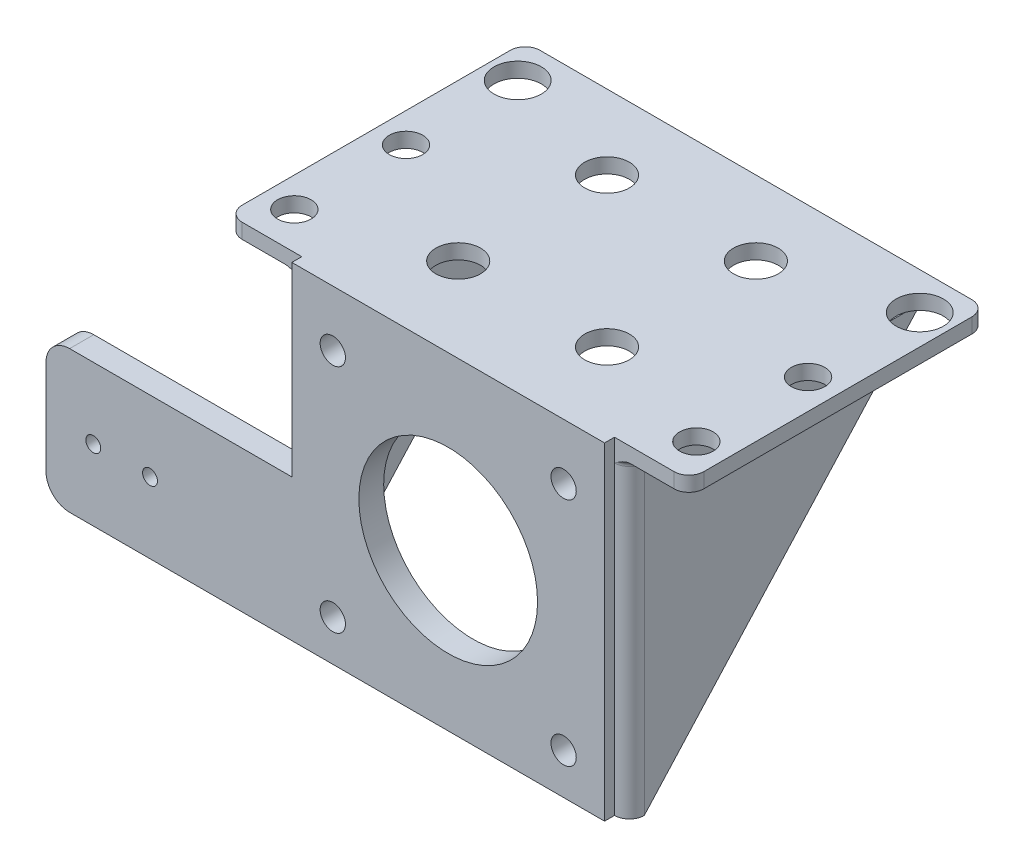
SolidWorks part; units mm, degrees
other "Solid1"
ref_plane "Front Plane" through (0, 0, 0) normal (0, 0, 1) x (1, 0, 0)
ref_plane "Top Plane" through (0, 0, 0) normal (0, 1, 0) x (1, 0, 0)
ref_plane "Right Plane" through (0, 0, 0) normal (1, 0, 0) x (0, 0, -1)
imported_body "Imported1"
sketch "Sketch1" plane through (0, 0, 2) normal (0, 0, 1) x (1, 0, 0)
  line L0 (-21, -11.475) -> (-54.02, -11.475) construction
  line L1 (-21, -21) -> (-50.845, -21)
  line L2 (-21, -21) -> (-21, -1.95)
  line L3 (-21, -1.95) -> (-50.845, -1.95)
  line L4 (-54.02, -17.825) -> (-54.02, -5.125)
  circle A0 centre (-40.05, -11.475) radius 1
  circle A1 centre (-47.67, -11.475) radius 1
  arc A2 (-50.845, -21) -> (-54.02, -17.825) centre (-50.845, -17.825) cw
  arc A3 (-50.845, -1.95) -> (-54.02, -5.125) centre (-50.845, -5.125) ccw
  point P11 (-53.4865, -11.475)
  point P17 (-54.02, -1.95)
  dimension "D1" = 7.62
  dimension "D3" = 2
  dimension "D6" = 3.175
  dimension "D2" = 19.05
  dimension "D4" = 6.35
  dimension "D5" = 19.05
extrude "Boss-Extrude1" add sketch "Sketch1" against normal blind 1.905
ref_plane "Plane1" through (0, -11.475, 0) normal (0, -1, 0) x (-1, 0, 0)
sketch "Sketch2" plane through (0, -11.475, 0) normal (0, -1, 0) x (1, 0, 0)
  line L0 (-23, 0.095) -> (-23, -7.7034)
  line L2 (-23, -7.7034) -> (-37.1371, 0.095)
  line L3 (-37.1371, 0.095) -> (-23, 0.095)
  line L4 (-23, -37.0952) -> (-23, 0) construction
  line L5 (-50.845, 0.095) -> (-22.9977, 0.095) construction
  point P2 (-23, -7.7034)
  point P8 (-37.1371, 0.095)
extrude "Boss-Extrude2" add sketch "Sketch2" along normal mid plane 1.905
sketch "Sketch3" plane through (0, 21, 0) normal (0, -1, 0) x (-1, 0, 0)
  line L0 (31, 18) -> (-31, 18) construction
  line L2 (31, 36) -> (31, 0) construction
  line L3 (9.9949, 27.9949) -> (-9.9949, 27.9949) construction
  line L4 (9.9949, 27.9949) -> (9.9949, 8.0051) construction
  line L5 (9.9949, 8.0051) -> (-9.9949, 8.0051) construction
  line L6 (-9.9949, 27.9949) -> (-9.9949, 8.0051) construction
  line L7 (9.9949, 27.9949) -> (-9.9949, 8.0051) construction
  line L8 (9.9949, 8.0051) -> (-9.9949, 27.9949) construction
  line L9 (-31, 0) -> (-31, 36) construction
  circle A0 centre (9.9949, 8.0051) radius 3
  circle A1 centre (9.9949, 27.9949) radius 3
  circle A2 centre (-9.9949, 27.9949) radius 3
  circle A3 centre (-9.9949, 8.0051) radius 3
  point P5 (0, 18)
  dimension "D1" = 6
  dimension "D2" = 19.9898
extrude "Cut-Extrude1" cut sketch "Sketch3" against normal through all
sketch "Sketch4" plane through (0, 0, 2) normal (0, 0, 1) x (1, 0, 0)
  line L0 (21, 20) -> (21, 23)
  line L1 (-21, 20) -> (-21, 23)
  line L11 (-50.845, -21) -> (21, -21)
  line L12 (21, -21) -> (21, 20)
  line L13 (23.2361, 21) -> (29, 21)
  line L14 (29, 21) -> (29, 23)
  line L15 (29, 23) -> (-29, 23)
  line L16 (-29, 23) -> (-29, 21)
  line L17 (-29, 21) -> (-23.2361, 21)
  line L18 (-21, 20) -> (-21, -1.95)
  line L19 (-21, -1.95) -> (-50.845, -1.95)
  line L20 (-54.02, -5.125) -> (-54.02, -17.825)
  line L21 (-50.845, -21) -> (21, -21)
  line L22 (21, -21) -> (21, 20)
  line L25 (21, 23) -> (-21, 23)
  line L28 (-21, 20) -> (-21, -1.95)
  line L29 (-21, -1.95) -> (-50.845, -1.95)
  line L30 (-54.02, -5.125) -> (-54.02, -17.825)
  circle A0 centre (-47.67, -11.475) radius 1 construction
  circle A1 centre (-40.05, -11.475) radius 1 construction
  arc A2 (-50.845, -1.95) -> (-54.02, -5.125) centre (-50.845, -5.125) ccw
  arc A3 (-54.02, -17.825) -> (-50.845, -21) centre (-50.845, -17.825) ccw
  arc A4 (-50.845, -1.95) -> (-54.02, -5.125) centre (-50.845, -5.125) ccw
  arc A5 (-54.02, -17.825) -> (-50.845, -21) centre (-50.845, -17.825) ccw
  circle A6 centre (-15.5, 15.5) radius 1.7 construction
  circle A7 centre (15.5, 15.5) radius 1.7 construction
  circle A8 centre (15.5, -15.5) radius 1.7 construction
  circle A9 centre (-15.5, -15.5) radius 1.7 construction
  circle A10 centre (0, 0) radius 12 construction
  circle A11 centre (-47.67, -11.475) radius 1
  circle A12 centre (-40.05, -11.475) radius 1
  circle A13 centre (-15.5, 15.5) radius 1.7
  circle A14 centre (15.5, 15.5) radius 1.7
  circle A15 centre (15.5, -15.5) radius 1.7
  circle A16 centre (-15.5, -15.5) radius 1.7
  circle A17 centre (0, 0) radius 12
  spline S2 degree 3 poles (-561.843, 832.5831) (12.6009, -2.0951) (13.1814, 14.8062) (21.6214, 20.4253) (21.9587, 20.6329) (22.3352, 20.8088) (22.6254, 20.9113) (27.647, 22.1403) (35.5807, 0.2241) (-91.368, 1014.3787) knots -11.720957 -11.720957 -11.720957 -11.720957 0.154455 0.249042 0.504451 0.630922 0.749207 0.875114 6.832567 6.832567 6.832567 6.832567 only from (21, 20) to (23.2361, 21)
  spline S3 degree 3 poles (51.7028, 1018.1851) (-32.9343, 4.7321) (-27.1386, 21.6821) (-22.8228, 20.9586) (-22.5927, 20.9003) (-22.3352, 20.8086) (-21.9588, 20.6329) (-12.0029, 14.537) (-13.7315, -7.7712) (586.2749, 814.487) knots -5.01052 -5.01052 -5.01052 -5.01052 0.083153 0.166831 0.250888 0.369141 0.495617 0.751 14.409277 14.409277 14.409277 14.409277 only from (-23.2361, 21) to (-21, 20)
  dimension "D1" = 0
extrude "Boss-Extrude3" add sketch "Sketch4" along normal blind 1.3335
sketch "Sketch5" plane through (0, 21, 0) normal (0, -1, 0) x (-1, 0, 0)
  circle A0 centre (27, 33) radius 3.175
  circle A1 centre (-27, 33) radius 3.175
  dimension "D1" = 6.35
extrude "Cut-Extrude2" cut sketch "Sketch5" against normal up to next
